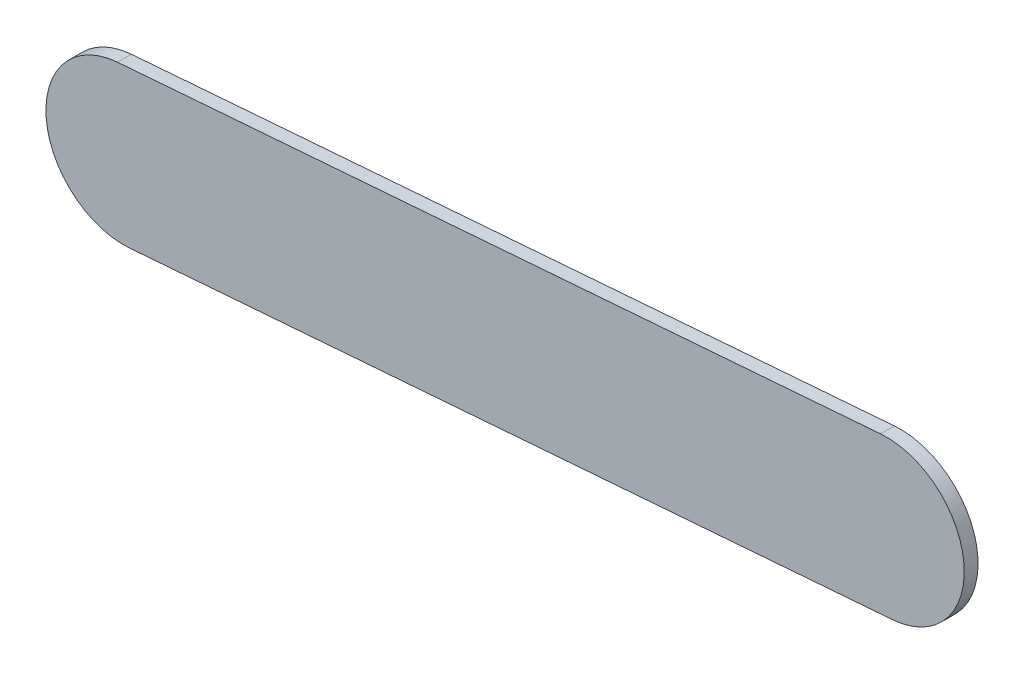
SolidWorks part; units mm, degrees
ref_plane "Front Plane" through (0, 0, 0) normal (0, 0, 1) x (1, 0, 0)
ref_plane "Top Plane" through (0, 0, 0) normal (0, 1, 0) x (1, 0, 0)
ref_plane "Right Plane" through (0, 0, 0) normal (1, 0, 0) x (0, 0, -1)
sketch "Sketch1" plane through (0, 0, 0) normal (0, 0, 1) x (1, 0, 0)
  line L0 (-67.9859, 0) -> (75.2185, 0) construction
  line L1 (-67.9859, 13.1994) -> (75.2185, 13.1994) construction
  line L2 (-67.9859, -13.1994) -> (75.2185, -13.1994) construction
  line L3 (-66.183, 3.2783) -> (74.1051, 14.2441) construction
  line L4 (76.3319, -14.2441) -> (-63.9562, -25.2098) construction
  line L5 (-66.183, 3.2783) -> (74.1051, 14.2441)
  line L6 (76.3319, -14.2441) -> (-63.9562, -25.2098)
  arc A0 (-67.9859, 13.1994) -> (-67.9859, -13.1994) centre (-67.9859, 0) ccw construction
  arc A1 (75.2185, -13.1994) -> (75.2185, 13.1994) centre (75.2185, 0) ccw construction
  arc A2 (76.3319, -14.2441) -> (74.1051, 14.2441) centre (75.2185, 0) ccw construction
  arc A3 (-66.183, 3.2783) -> (-63.9562, -25.2098) centre (-65.0696, -10.9657) ccw construction
  arc A4 (76.3319, -14.2441) -> (74.1051, 14.2441) centre (75.2185, 0) ccw
  arc A5 (-66.183, 3.2783) -> (-63.9562, -25.2098) centre (-65.0696, -10.9657) ccw
  point P3 (3.6163, 0)
extrude "Boss-Extrude1" add sketch "Sketch1" along normal blind 2.54
